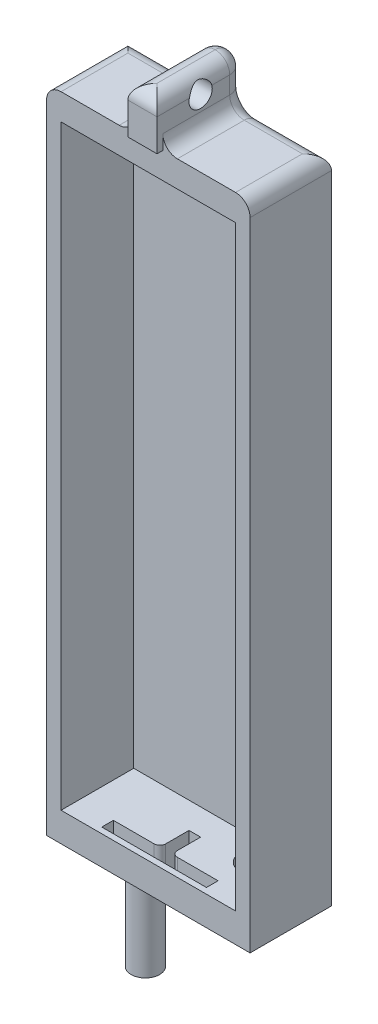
SolidWorks part; units mm, degrees
ref_plane "정면" through (0, 0, 0) normal (0, 0, 1) x (1, 0, 0)
ref_plane "윗면" through (0, 0, 0) normal (0, 1, 0) x (1, 0, 0)
ref_plane "우측면" through (0, 0, 0) normal (1, 0, 0) x (0, 0, -1)
sketch "스케치1" plane through (0, 0, 0) normal (0, 0, 1) x (1, 0, 0)
  line L1 (-17.5, -55) -> (17.5, -55)
  line L2 (-17.5, -55) -> (-17.5, 55)
  line L3 (-17.5, 55) -> (17.5, 55)
  line L4 (17.5, -55) -> (17.5, 55)
  line L5 (-17.5, -55) -> (17.5, 55) construction
  line L6 (-17.5, 55) -> (17.5, -55) construction
  point P0 (0, 0)
  dimension "D1" = 35
  dimension "D2" = 110
extrude "보스-돌출1" add sketch "스케치1" along normal blind 15
sketch "스케치2" plane through (0, 0, 15) normal (0, 0, 1) x (1, 0, 0)
  line L0 (-15, -50) -> (-5, -50)
  line L1 (-15, 52.5) -> (15, 52.5)
  line L2 (-15, 52.5) -> (-15, -50)
  line L4 (15, 52.5) -> (15, -50)
  line L5 (17.5, 55) -> (-17.5, 55) construction
  line L6 (-17.5, 55) -> (-17.5, -55) construction
  line L7 (17.5, -55) -> (17.5, 55) construction
  line L9 (5, -50) -> (15, -50)
  line L10 (-17.5, -55) -> (17.5, -55) construction
  line L12 (-5, -50) -> (5, -50)
  dimension "D1" = 2.5
  dimension "D2" = 2.5
  dimension "D3" = 2.5
  dimension "D5" = 10
  dimension "D6" = 5
extrude "컷-돌출1" cut sketch "스케치2" against normal offset from surface (13.5 mm away) 1.5
sketch "스케치3" plane through (0, -55, 0) normal (0, -1, 0) x (1, 0, 0)
  line L0 (17.5, 15) -> (17.5, 0) construction
  line L2 (-17.5, 15) -> (17.5, 15) construction
  point P0 (9.5, 5)
  dimension "D1" = 8
  dimension "D2" = 10
hole_wizard "M5 여유 구멍1" positions "3D스케치1" profile "스케치5" hole size "M5" standard "KS"
sketch3d "3D스케치1"
  point P0 (9.5, -55, 5)
  point P4 (9.5, -55, 5)
sketch "스케치5" plane through (9.5, -55, 5) normal (1, 0, 0) x (0, 0, -1)
  line L0 (0, 0) -> (0, 6.6524)
  line L1 (0, 6.6524) -> (2.75, 5)
  line L2 (2.75, 5) -> (2.75, 0)
  line L5 (2.75, 0) -> (0, 0)
  line L10 (0, 6.6524) -> (-2.75, 5) construction
  line L11 (0, -6.35) -> (0, 107.95) construction
  dimension "구멍 지름" = 5.5
  dimension "구멍 깊이" = 5
  dimension "드릴 각도" = 118
sketch "스케치6" plane through (0, -55, 0) normal (0, -1, 0) x (-1, 0, 0)
  line L0 (17.5, -15) -> (-17.5, -15) construction
  line L6 (-9, -11) -> (-1, -11)
  line L8 (-9, -11) -> (-9, -13)
  line L9 (-9, -13) -> (9, -13)
  line L10 (9, -11) -> (9, -13)
  line L11 (1, -11) -> (9, -11)
  line L12 (-1, -6) -> (1, -6)
  line L13 (-1, -6) -> (-1, -11)
  line L15 (1, -6) -> (1, -11)
  point P12 (0, -6)
  point P13 (0, -13)
  dimension "D1" = 2
  dimension "D2" = 2
  dimension "D3" = 18
  dimension "D4" = 2
  dimension "D5" = 5
extrude "컷-돌출2" cut sketch "스케치6" against normal up to surface (5 mm away)
sketch "스케치7" plane through (0, 55, 0) normal (0, 1, 0) x (1, 0, 0)
  line L8 (17.5, 0) -> (-17.5, 0)
  line L9 (-17.5, 0) -> (-17.5, -15)
  line L10 (-17.5, -15) -> (17.5, -15)
  line L11 (17.5, -15) -> (17.5, 0)
  line L12 (17.5, 0) -> (-17.5, 0)
  line L13 (-17.5, 0) -> (-17.5, -15)
  line L14 (-17.5, -15) -> (17.5, -15)
  line L15 (17.5, -15) -> (17.5, 0)
  dimension "D1" = 0
extrude "보스-돌출2" add sketch "스케치7" along normal blind 10
fillet "필렛2" radius 8 2 edges at (-17.5, 65, 7.5) (17.5, 65, 7.5)
sketch "스케치12" plane through (0, 0, 15) normal (0, 0, 1) x (1, 0, 0)
  line L1 (-17.5, 57) -> (17.5, 57)
  line L2 (-17.5, 57) -> (-17.5, -55)
  line L3 (-17.5, -55) -> (17.5, -55)
  line L4 (17.5, 57) -> (17.5, -55)
extrude "컷-돌출7" cut sketch "스케치12" against normal blind 1
fillet "필렛11" radius 1 2 edges at (1, -52.5, 11) (-1, -52.5, 11)
sketch "스케치13" plane through (17.5, 0, 0) normal (1, 0, 0) x (0, 0, -1)
  line L1 (0, 57) -> (-15, 57)
  line L2 (0, 57) -> (0, 65)
  line L3 (0, 65) -> (-15, 65)
  line L4 (-15, 57) -> (-15, 65)
extrude "컷-돌출8" cut sketch "스케치13" against normal blind 15
mirror "대칭 복사1" about plane through (0, 0, 0) normal (1, 0, 0) of "컷-돌출8"
sketch "스케치14" plane through (-2.5, 0, 0) normal (-1, 0, 0) x (0, 0, 1)
  line L0 (0, 65) -> (15, 65) construction
  circle A0 centre (7.5, 62) radius 2
  point P4 (7.5, 65)
  dimension "D1" = 4
  dimension "D2" = 3
extrude "컷-돌출9" cut sketch "스케치14" against normal through all
fillet "필렛12" radius 2.5 11 edges at (-2.5, 61, 0) (2.5, 61, 0) (2.5, 65, 7.5) (0, 65, 15) (-2.5, 65, 7.5) (-10, 57, 0) (10, 57, 0) (2.5, 57, 7) (17.5, 57, 7) (-17.5, 57, 7) (-2.5, 57, 7)
sketch "스케치16" plane through (0, -55, 0) normal (0, -1, 0) x (1, 0, 0)
  line L1 (-17.5, 14) -> (-17.5, 0) construction
  line L2 (2.5, 15) -> (-2.5, 15) construction
  circle A0 centre (-9.5, 5) radius 2.45
  dimension "D3" = 4.9
  dimension "D1" = 10
  dimension "D2" = 8
extrude "보스-돌출4" add sketch "스케치16" along normal blind 20
